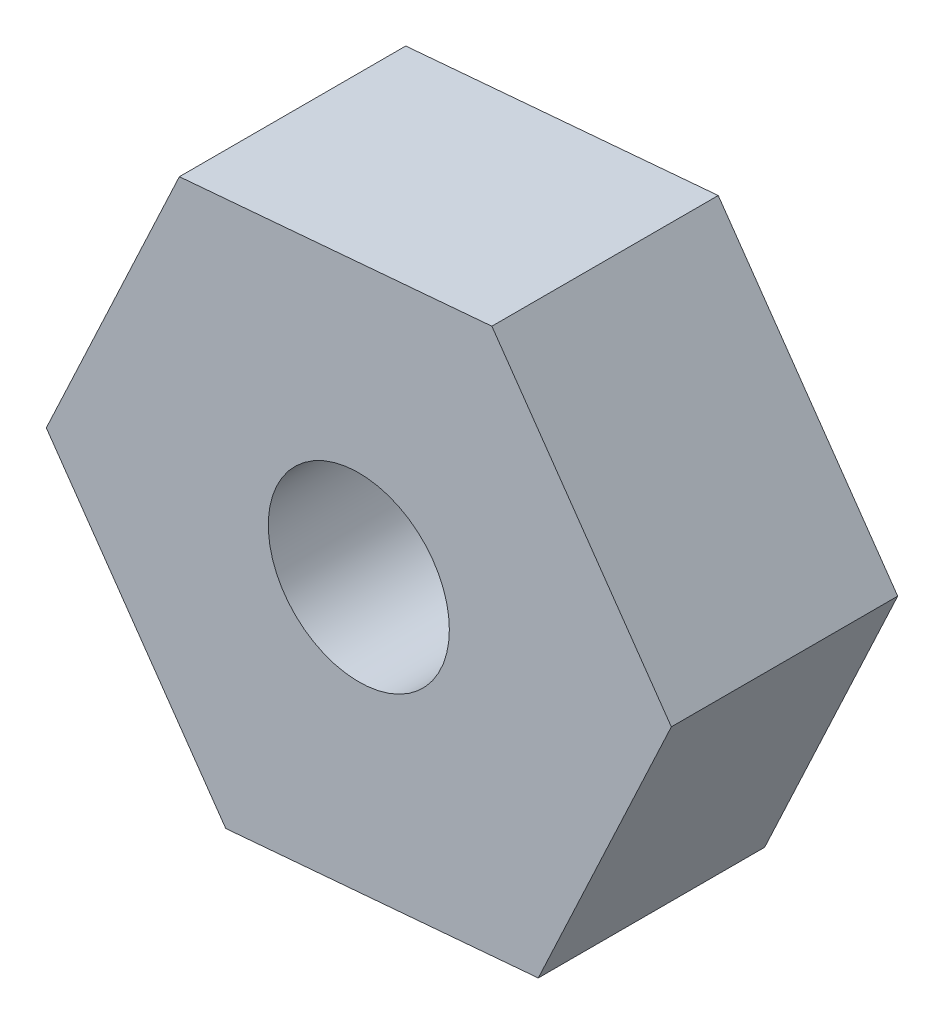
SolidWorks part; units mm, degrees
ref_plane "Front Plane" through (0, 0, 0) normal (0, 0, 1) x (1, 0, 0)
ref_plane "Top Plane" through (0, 0, 0) normal (0, 1, 0) x (1, 0, 0)
ref_plane "Right Plane" through (0, 0, 0) normal (1, 0, 0) x (0, 0, -1)
sketch "Sketch1" plane through (0, 0, 0) normal (0, 0, 1) x (1, 0, 0)
  line L1 (5.0341, -7.2165) -> (8.7667, 0.7514)
  line L2 (8.7667, 0.7514) -> (3.7326, 7.9679)
  line L3 (3.7326, 7.9679) -> (-5.0341, 7.2165)
  line L4 (-5.0341, 7.2165) -> (-8.7667, -0.7514)
  line L5 (-8.7667, -0.7514) -> (-3.7326, -7.9679)
  line L6 (-3.7326, -7.9679) -> (5.0341, -7.2165)
  circle A0 centre (0, 0) radius 7.62 construction
  circle A1 centre (0, 0) radius 2.54
extrude "Boss-Extrude1" add sketch "Sketch1" along normal blind 6.35
